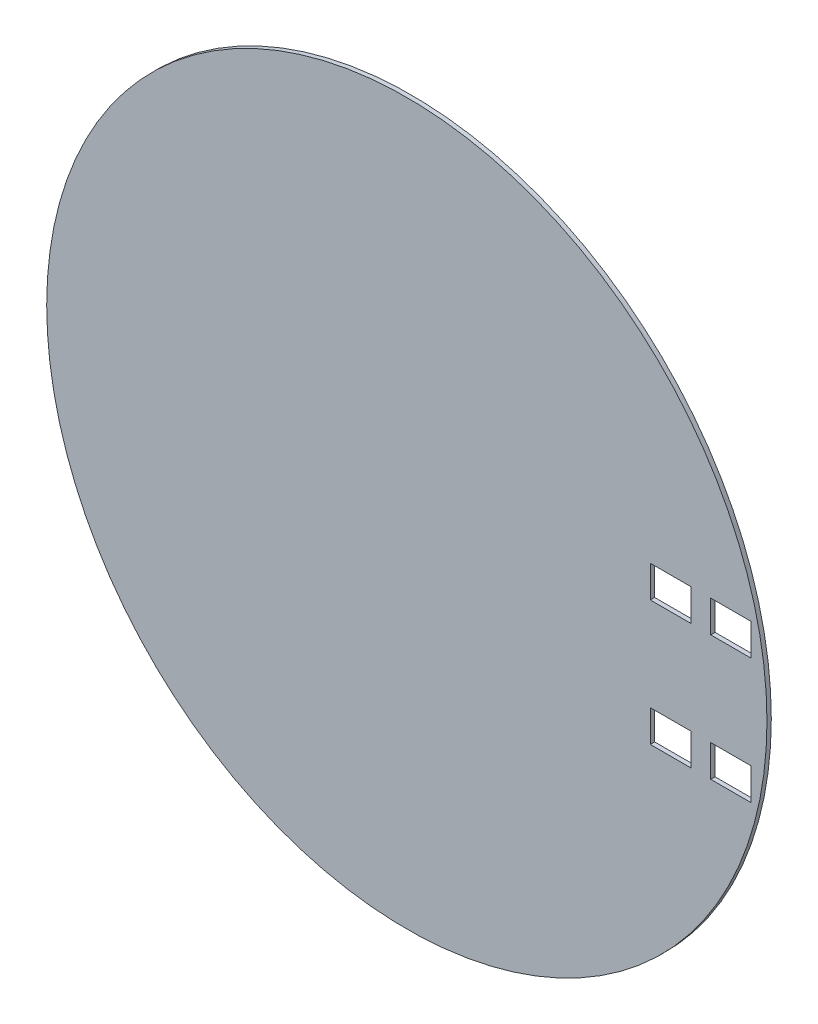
SolidWorks part; units mm, degrees
ref_plane "前视基准面" through (0, 0, 0) normal (0, 0, 1) x (1, 0, 0)
ref_plane "上视基准面" through (0, 0, 0) normal (0, 1, 0) x (1, 0, 0)
ref_plane "右视基准面" through (0, 0, 0) normal (1, 0, 0) x (0, 0, -1)
other "Configuration Table"
sketch "Reference_only_die_cut_film_with_adhesive0_3_Sketch" plane through (0, 0, 0) normal (0, 0, 1) x (1, 0, 0)
  circle A0 centre (0, 0) radius 24.9
extrude "Reference_only_die_cut_film_with_adhesive0_3" add sketch "Reference_only_die_cut_film_with_adhesive0_3_Sketch" along normal blind 0.3 from offset 1.5
sketch "USB_SH_relief_18.232_-4.3251_Sketch" plane through (0, 0, 0) normal (0, 0, 1) x (1, 0, 0)
  line L1 (16.832, -5.4251) -> (19.632, -5.4251)
  line L2 (16.832, -5.4251) -> (16.832, -3.2251)
  line L3 (16.832, -3.2251) -> (19.632, -3.2251)
  line L4 (19.632, -5.4251) -> (19.632, -3.2251)
extrude "USB_SH_relief_18.232_-4.3251" cut sketch "USB_SH_relief_18.232_-4.3251_Sketch" along normal blind 0.32 from offset 1.49
sketch "USB_SH_relief_18.232_4.3251_Sketch" plane through (0, 0, 0) normal (0, 0, 1) x (1, 0, 0)
  line L1 (16.832, 3.2251) -> (19.632, 3.2251)
  line L2 (16.832, 3.2251) -> (16.832, 5.4251)
  line L3 (16.832, 5.4251) -> (19.632, 5.4251)
  line L4 (19.632, 3.2251) -> (19.632, 5.4251)
extrude "USB_SH_relief_18.232_4.3251" cut sketch "USB_SH_relief_18.232_4.3251_Sketch" along normal blind 0.32 from offset 1.49
sketch "USB_SH_relief_22.4118_-4.3251_Sketch" plane through (0, 0, 0) normal (0, 0, 1) x (1, 0, 0)
  line L1 (21.0118, -5.4251) -> (23.8118, -5.4251)
  line L2 (21.0118, -5.4251) -> (21.0118, -3.2251)
  line L3 (21.0118, -3.2251) -> (23.8118, -3.2251)
  line L4 (23.8118, -5.4251) -> (23.8118, -3.2251)
extrude "USB_SH_relief_22.4118_-4.3251" cut sketch "USB_SH_relief_22.4118_-4.3251_Sketch" along normal blind 0.32 from offset 1.49
sketch "USB_SH_relief_22.4118_4.3251_Sketch" plane through (0, 0, 0) normal (0, 0, 1) x (1, 0, 0)
  line L1 (21.0118, 3.2251) -> (23.8118, 3.2251)
  line L2 (21.0118, 3.2251) -> (21.0118, 5.4251)
  line L3 (21.0118, 5.4251) -> (23.8118, 5.4251)
  line L4 (23.8118, 3.2251) -> (23.8118, 5.4251)
extrude "USB_SH_relief_22.4118_4.3251" cut sketch "USB_SH_relief_22.4118_4.3251_Sketch" along normal blind 0.32 from offset 1.49
